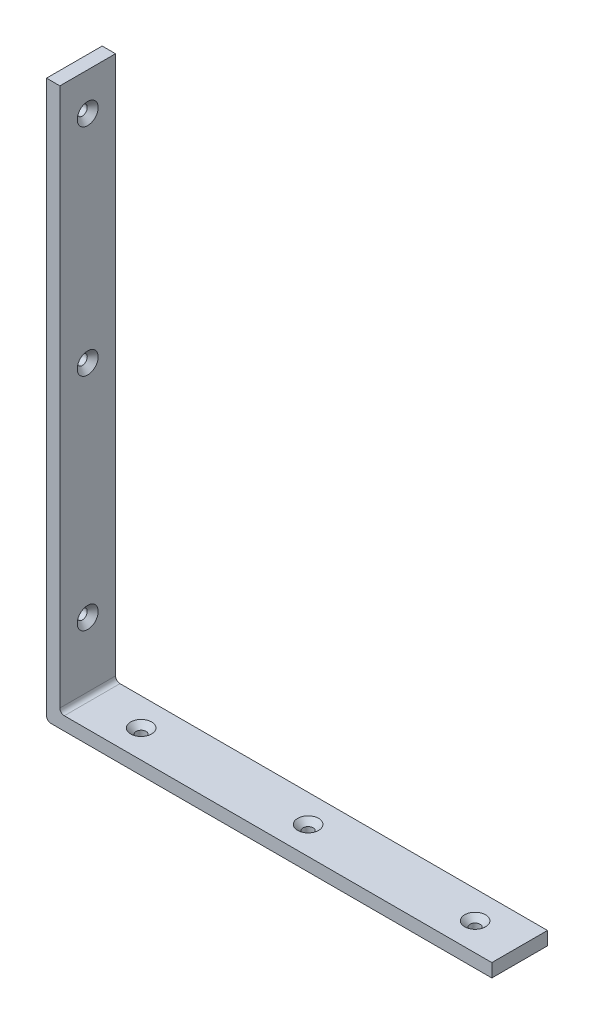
SolidWorks part; units mm, degrees
ref_plane "Front Plane" through (0, 0, 0) normal (0, 0, 1) x (1, 0, 0)
ref_plane "Top Plane" through (0, 0, 0) normal (0, 1, 0) x (1, 0, 0)
ref_plane "Right Plane" through (0, 0, 0) normal (1, 0, 0) x (0, 0, -1)
sketch "Sketch1" plane through (0, 0, 0) normal (0, 0, 1) x (1, 0, 0)
  line L0 (-94, 125) -> (-94, -119)
  line L1 (100, -125) -> (-100, -125)
  line L2 (100, -125) -> (100, 125) construction
  line L3 (100, 125) -> (-100, 125) construction
  line L4 (-100, -125) -> (-100, 125)
  line L5 (100, -125) -> (-100, 125) construction
  line L6 (100, 125) -> (-100, -125) construction
  line L7 (-94, -119) -> (100, -119)
  line L8 (100, -119) -> (100, -125)
  line L9 (100, -125) -> (100.1624, -125.0048)
  line L10 (-100, 125) -> (-94, 125)
  point P0 (0, 0)
  dimension "D1" = 200
  dimension "D2" = 250
  dimension "D3" = 6
  dimension "D4" = 6
extrude "Boss-Extrude1" add sketch "Sketch1" along normal blind 25 contours L1 L4 L10 L0 L7 L8
fillet "Fillet1" radius 2 1 edges at (-94, -119, 12.5)
fillet "Fillet2" radius 2 1 edges at (-100, -125, 12.5)
hole_wizard "CSK for M4 Flat Head Machine Screw1" positions "Sketch3" profile "Sketch4" countersink size "M4" standard "ANSI Metric"
sketch "Sketch3" plane through (0, -119, 0) normal (0, 1, 0) x (1, 0, 0)
  line L0 (100, -25) -> (100, 0) construction
  point P0 (-70, -12.5)
  point P3 (5, -12.5)
  point P6 (80, -12.5)
  dimension "D1" = 20
  dimension "D2" = 95
  dimension "D3" = 170
sketch "Sketch4" plane through (-70, -119, 12.5) normal (1, 0, 0) x (0, 0, 1)
  line L0 (0, 0) -> (0, 6)
  line L1 (0, 6) -> (2.25, 6)
  line L2 (2.25, 6) -> (2.25, 2.45)
  line L3 (2.25, 2.45) -> (4.7, 0)
  line L5 (4.7, 0) -> (0, 0)
  line L6 (-2.25, 2.45) -> (-4.7, 0) construction
  line L11 (0, -6.35) -> (0, 107.95) construction
  dimension "Thru Hole Dia." = 4.5
  dimension "Thru Hole Depth" = 6
  dimension "Near C'Sink Dia." = 9.4
  dimension "Near C'Sink Angle" = 90
hole_wizard "CSK for M4 Flat Head Machine Screw2" positions "Sketch5" profile "Sketch6" countersink size "M4" standard "ANSI Metric"
sketch "Sketch5" plane through (-94, 0, 0) normal (1, 0, 0) x (0, 0, -1)
  line L3 (-25, 125) -> (0, 125) construction
  line L4 (-12.5, 125) -> (-12.5, -117) construction
  line L5 (-25, -117) -> (0, -117) construction
  point P0 (-12.5, -88)
  point P2 (-12.5, 11)
  point P4 (-12.5, 108)
  dimension "D1" = 17
  dimension "D2" = 114
  dimension "D3" = 213
sketch "Sketch6" plane through (-94, -88, 12.5) normal (0, 1, 0) x (0, 0, -1)
  line L0 (0, 0) -> (0, 6)
  line L1 (0, 6) -> (2.25, 6)
  line L2 (2.25, 6) -> (2.25, 2.45)
  line L3 (2.25, 2.45) -> (4.7, 0)
  line L5 (4.7, 0) -> (0, 0)
  line L6 (-2.25, 2.45) -> (-4.7, 0) construction
  line L11 (0, -6.35) -> (0, 107.95) construction
  dimension "Thru Hole Dia." = 4.5
  dimension "Thru Hole Depth" = 6
  dimension "Near C'Sink Dia." = 9.4
  dimension "Near C'Sink Angle" = 90
ref_plane "Plane1" through (0, 0, 12.5) normal (0, 0, -1) x (-1, 0, 0)
